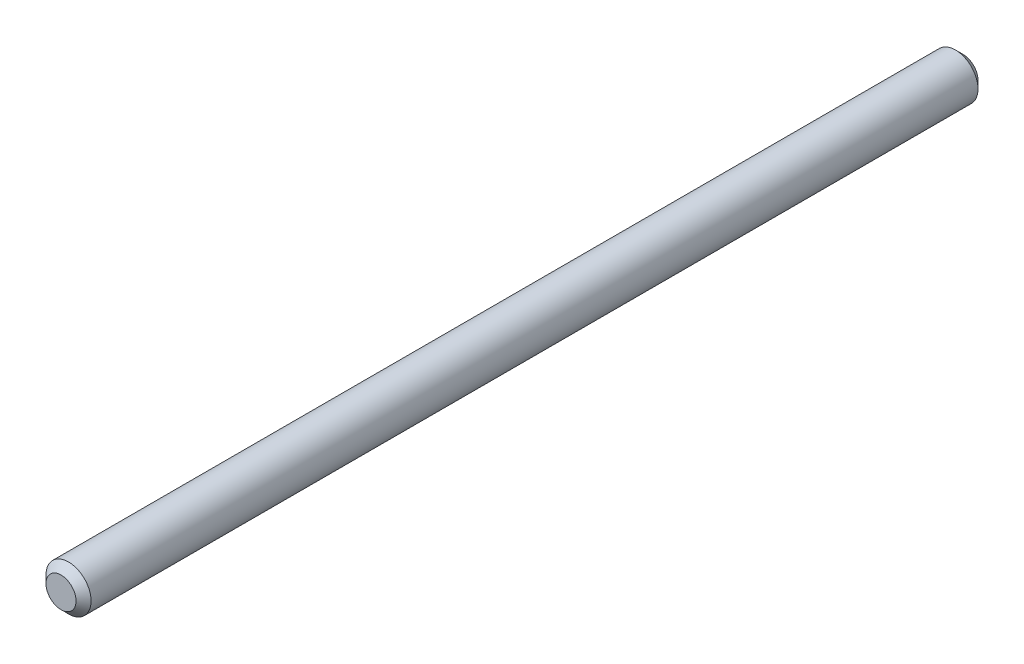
SolidWorks part; units mm, degrees
ref_plane "Face" through (0, 0, 0) normal (0, 0, 1) x (1, 0, 0)
ref_plane "Dessus" through (0, 0, 0) normal (0, 1, 0) x (1, 0, 0)
ref_plane "Droite" through (0, 0, 0) normal (1, 0, 0) x (0, 0, -1)
sketch "Esquisse1" plane through (0, 0, 0) normal (0, 0, 1) x (1, 0, 0)
  circle A0 centre (0, 0) radius 1.5
  dimension "D1" = 3
extrude "Extrusion1" add sketch "Esquisse1" along normal blind 60
chamfer "Chanfrein1" distance 0.5 angle 45 2 edges at (1.5, 0, 0) (1.5, 0, 60)
